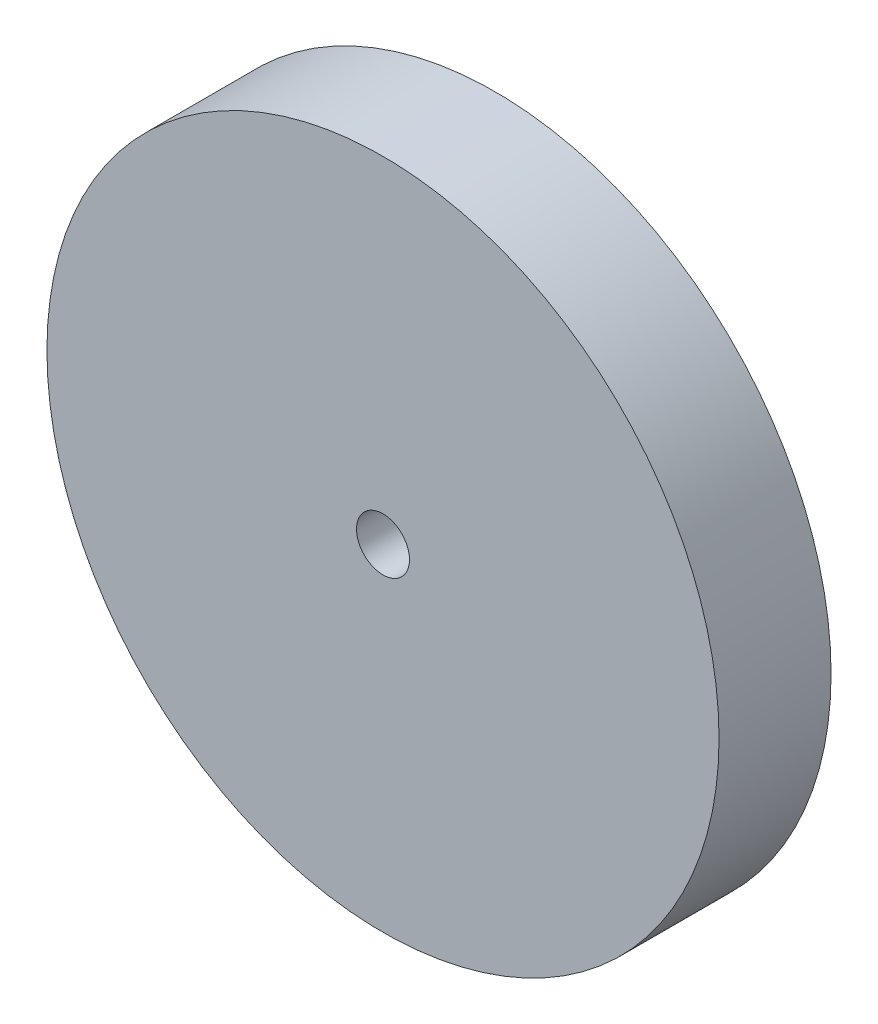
SolidWorks part; units mm, degrees
ref_plane "Front Plane" through (0, 0, 0) normal (0, 0, 1) x (1, 0, 0)
ref_plane "Top Plane" through (0, 0, 0) normal (0, 1, 0) x (1, 0, 0)
ref_plane "Right Plane" through (0, 0, 0) normal (1, 0, 0) x (0, 0, -1)
sketch "Sketch1" plane through (0, 0, 0) normal (0, 0, 1) x (1, 0, 0)
  circle A0 centre (0, 0) radius 38.1
  circle A1 centre (0, 0) radius 3
  dimension "D1" = 76.2
  dimension "D2" = 6
extrude "Boss-Extrude1" add sketch "Sketch1" along normal blind 12.7
